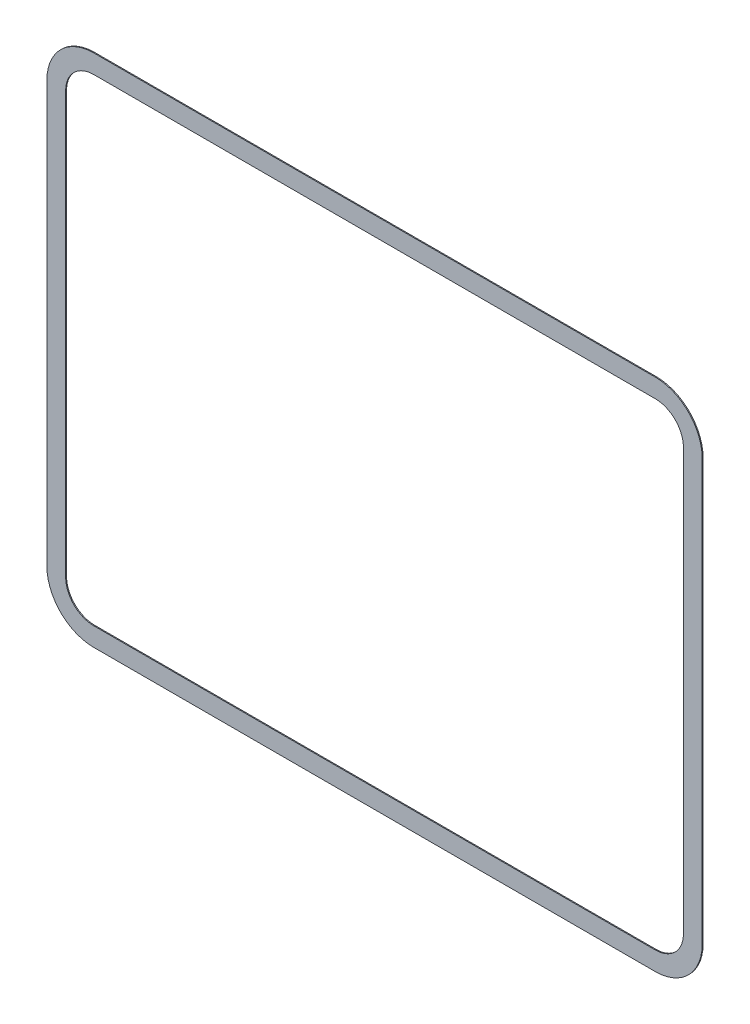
SolidWorks part; units mm, degrees
ref_plane "Plan de face" through (0, 0, 0) normal (0, 0, 1) x (1, 0, 0)
ref_plane "Plan de dessus" through (0, 0, 0) normal (0, 1, 0) x (1, 0, 0)
ref_plane "Plan de droite" through (0, 0, 0) normal (1, 0, 0) x (0, 0, -1)
sketch "Esquisse1" plane through (0, 0, 0) normal (0, 0, 1) x (1, 0, 0)
  line L0 (-2, 50) -> (-2, 5)
  line L1 (-65, 55) -> (-5, 55)
  line L2 (-70, 50) -> (-70, 5)
  line L3 (-65, 0) -> (-5, 0)
  line L4 (0, 50) -> (0, 5)
  line L5 (-65, 2) -> (-5, 2)
  line L6 (-68, 50) -> (-68, 5)
  line L7 (-65, 53) -> (-5, 53)
  arc A0 (-70, 5) -> (-65, 0) centre (-65, 5) ccw
  arc A1 (-5, 0) -> (0, 5) centre (-5, 5) ccw
  arc A2 (-5, 55) -> (0, 50) centre (-5, 50) cw
  arc A3 (-65, 55) -> (-70, 50) centre (-65, 50) ccw
  arc A4 (-5, 2) -> (-2, 5) centre (-5, 5) ccw
  arc A5 (-68, 5) -> (-65, 2) centre (-65, 5) ccw
  arc A6 (-65, 53) -> (-68, 50) centre (-65, 50) ccw
  arc A7 (-5, 53) -> (-2, 50) centre (-5, 50) cw
  point P11 (0, 55)
  point P14 (-70, 55)
  dimension "D3" = 5
  dimension "D1" = 70
  dimension "D2" = 2
extrude "Extrusion1" add sketch "Esquisse1" along normal blind 0.1
